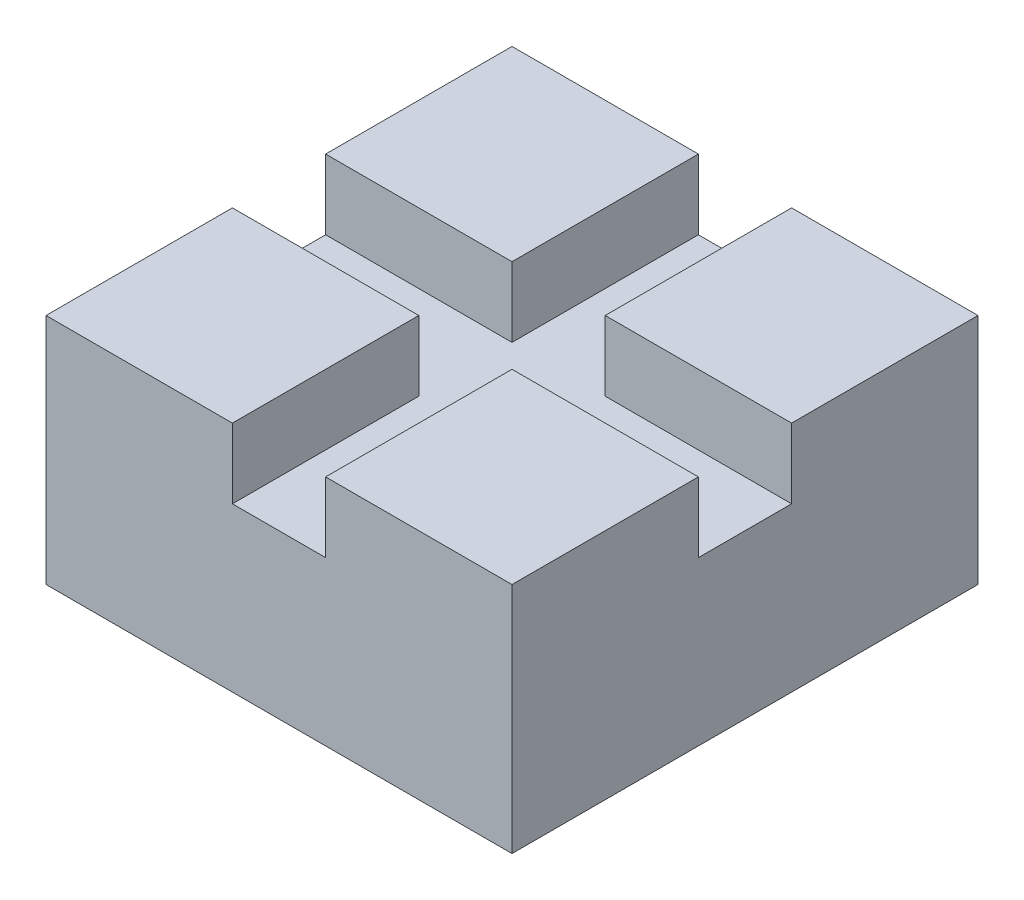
SolidWorks part; units mm, degrees
ref_plane "前视基准面" through (0, 0, 0) normal (0, 0, 1) x (1, 0, 0)
ref_plane "上视基准面" through (0, 0, 0) normal (0, 1, 0) x (1, 0, 0)
ref_plane "右视基准面" through (0, 0, 0) normal (1, 0, 0) x (0, 0, -1)
other "Configuration Table"
sketch "草图1" plane through (0, 0, 0) normal (0, 1, 0) x (1, 0, 0)
  line L1 (-40, -40) -> (40, -40)
  line L2 (-40, -40) -> (-40, 40)
  line L3 (-40, 40) -> (40, 40)
  line L4 (40, -40) -> (40, 40)
  line L5 (-40, -40) -> (40, 40) construction
  line L6 (-40, 40) -> (40, -40) construction
  point P0 (0, 0)
extrude "凸台-拉伸1" add sketch "草图1" along normal blind 40
sketch "草图2" plane through (0, 40, 0) normal (0, 1, 0) x (1, 0, 0)
  line L0 (8, 8) -> (40, 8)
  line L1 (40, -40) -> (40, 40) construction
  line L2 (40, 8) -> (40, -8)
  line L3 (40, -8) -> (8, -8)
  line L4 (8, -8) -> (8, -40)
  line L5 (-40, -40) -> (40, -40) construction
  line L6 (8, -40) -> (-8, -40)
  line L7 (-8, -40) -> (-8, -8)
  line L8 (-8, -8) -> (-40, -8)
  line L9 (-40, 40) -> (-40, -40) construction
  line L10 (-40, -8) -> (-40, 8)
  line L11 (-40, 8) -> (-8, 8)
  line L12 (-8, 8) -> (-8, 40)
  line L13 (40, 40) -> (-40, 40) construction
  line L14 (-8, 40) -> (8, 40)
  line L15 (8, 40) -> (8, 8)
extrude "切除-拉伸1" cut sketch "草图2" against normal blind 12
